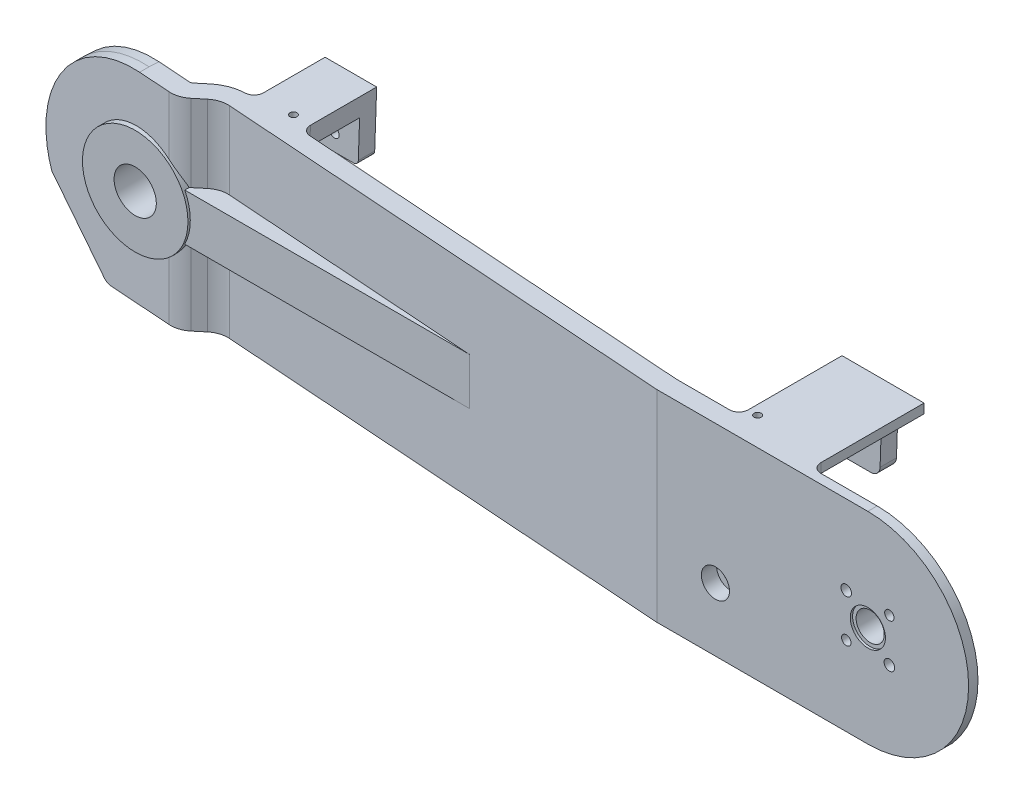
SolidWorks part; units mm, degrees
ref_plane "Plan de face" through (0, 0, 0) normal (0, 0, 1) x (1, 0, 0)
ref_plane "Plan de dessus" through (0, 0, 0) normal (0, 1, 0) x (1, 0, 0)
ref_plane "Plan de droite" through (0, 0, 0) normal (1, 0, 0) x (0, 0, -1)
ref_plane "Face-avt bras droit01_Rendre symétrique" through (0, 0, 112) normal (0, 0, -1) x (1, 0, 0)
ref_plane "Dessus-avt bras droit01_Rendre symétrique" through (0, 0, 112) normal (0, 1, 0) x (1, 0, 0)
ref_plane "Droite-avt bras droit01_Rendre symétrique" through (0, 0, 112) normal (1, 0, 0) x (0, 0, 1)
ref_plane "Plan1-avt bras droit01_Rendre symétrique" through (-65, 0, 112) normal (1, 0, 0) x (0, 0, 1)
ref_plane "Plan2-avt bras droit01_Rendre symétrique" through (0, 0, 107) normal (0, 0, -1) x (1, 0, 0)
mirrored part "avt bras droit01_Rendre symétrique"
other "<avt bras droit01>-<Enlèv. mat.-Extru.10>"
sketch "Esquisse1" plane through (-8.3003, 0, 118.6995) normal (0.0698, 0, -0.9976) x (-0.9976, 0, -0.0698)
  line L0 (374.2222, 0) -> (255.539, 0) construction
  line L1 (304.4642, -13.4937) -> (373.9552, -53.6144) construction
  line L2 (311.0924, 0) -> (380.1252, -39.8561) construction
  line L3 (345.6088, -19.9281) -> (348.779, -21.7584)
  line L4 (349.2614, -24.8331) -> (341.7072, -33.1734)
  line L5 (339.2249, -33.5628) -> (335.3077, -31.3012)
  line L6 (350.0723, -15) -> (325.9058, -41.6816) construction
  line L7 (335.3077, -31.3012) -> (345.6088, -19.9281)
  line L8 (322.9411, -38.9964) -> (346.5797, -12.8976) construction
  arc A0 (341.7072, -33.1734) -> (339.2249, -33.5628) centre (340.2249, -31.8308) cw
  arc A1 (349.2614, -24.8331) -> (348.779, -21.7584) centre (347.779, -23.4905) ccw
  point P16 (340.6233, -34.3702)
  point P19 (350.9244, -22.997)
  dimension "D4" = 2
  dimension "D1" = 30
  dimension "D2" = 15
  dimension "D3" = 10
extrude "Extrusion1" add sketch "Esquisse1" against normal blind 4
fillet "Congé1" radius 4 2 edges at (-342.9307, -31.3012, 97.3048) (-353.2067, -19.9281, 96.5862)
sketch "Esquisse3" plane through (0, 0, 108) normal (0, 0, -1) x (-1, 0, 0)
  line L0 (288.1927, 17) -> (248.346, 17) construction
  line L1 (283.5, 43) -> (261.5, 43)
  line L2 (285.9983, 43) -> (90, 43) construction
  line L3 (261.5, 43) -> (262.4079, 17)
  line L4 (262.4079, 17) -> (282.5921, 17)
  line L5 (261.5, -17.7423) -> (261.5, 76.5444) construction
  line L6 (283.5, -21.9852) -> (283.5, 85.973) construction
  line L7 (272.5, -68.5937) -> (272.5, 142.1371) construction
  line L8 (282.5921, 17) -> (283.5, 43)
  point P15 (282.5921, 17)
  dimension "D1" = 26
  dimension "D2" = 2
  dimension "D3" = 2
  dimension "D4" = 11
  dimension "D5" = 272.5
  dimension "D6" = 22
extrude "Extrusion2" add sketch "Esquisse3" along normal blind 52
sketch "Esquisse4" plane through (0, 43, 0) normal (0, 1, 0) x (-1, 0, 0)
  line L0 (261.5, 100.0076) -> (283.5, 98.4692)
  line L1 (283.5, 98.4692) -> (283.5, 108)
  line L2 (283.5, 108) -> (261.5, 108)
  line L3 (261.5, 108) -> (261.5, 100.0076)
extrude "Enlèv. mat.-Extru.1" cut sketch "Esquisse4" against normal blind 52
sketch "Esquisse5" plane through (0, 17, 0) normal (0, -1, 0) x (1, 0, 0)
  line L0 (-283.9673, 94.4267) -> (-258.9183, 96.1783)
  line L1 (-262.4079, 95.9343) -> (-282.5921, 94.5229) construction
  line L5 (-258.9183, 96.1783) -> (-258.9183, 63)
  line L8 (-258.9183, 63) -> (-285.7473, 63)
  line L10 (-285.7473, 63) -> (-283.9673, 94.4267)
  line L11 (-262.4079, 56) -> (-282.5921, 56) construction
  dimension "D1" = 7
extrude "Enlèv. mat.-Extru.2" cut sketch "Esquisse5" against normal blind 18
fillet "Congé2" radius 2 1 edges at (-262.4079, 17, 59.5)
fillet "Congé3" radius 2 1 edges at (-282.5921, 17, 59.5)
ref_plane "Plan1" through (0, 0, 116) normal (0, 0, -1) x (-1, 0, 0)
sketch "Esquisse6" plane through (0, 0, 56) normal (0, 0, -1) x (-1, 0, 0)
  line L0 (283.5, -43) -> (261.5, -43)
  line L1 (285.4403, -43) -> (87.4759, -43) construction
  line L2 (261.5, -43) -> (262.6548, -9.9302)
  line L3 (264.6536, -8) -> (280.3464, -8)
  line L4 (282.3452, -9.9302) -> (283.5, -43)
  line L5 (272.5, 3.5787) -> (272.5, -77.0567) construction
  line L6 (261.5, -43) -> (261.5, 11.6966) construction
  line L7 (283.5, -43) -> (283.5, 7.7341) construction
  arc A0 (262.6548, -9.9302) -> (264.6536, -8) centre (264.6536, -10) cw
  arc A1 (282.3452, -9.9302) -> (280.3464, -8) centre (280.3464, -10) ccw
  dimension "D3" = 2
  dimension "D1" = 2
  dimension "D2" = 2
  dimension "D4" = 272.5
  dimension "D5" = 35
  dimension "D6" = 11
  dimension "D7" = 11
extrude "Extrusion3" add sketch "Esquisse6" against normal up to body separate body
sketch "Esquisse7" plane through (0, -8, 0) normal (0, 1, 0) x (-1, 0, 0)
  line L0 (286.294, 94.264) -> (257.961, 96.2453)
  line L1 (280.3464, 94.6799) -> (264.6536, 95.7773) construction
  line L2 (257.961, 96.2453) -> (257.961, 63)
  line L3 (257.961, 63) -> (286.294, 63)
  line L4 (286.294, 63) -> (286.294, 94.264)
  line L5 (280.3464, 56) -> (264.6536, 56) construction
  dimension "D1" = 7
extrude "Enlèv. mat.-Extru.3" cut sketch "Esquisse7" against normal blind 28
fillet "Congé4" radius 4 8 edges at (-285.4403, -41, 90.3139) (-285.4403, 41, 90.3139) (-63, 41, 104) (-28, 41, 108) (-283.4302, 41, 90.4545) (-261.5698, 41, 91.9831) (-283.4302, -41, 90.4545) (-261.5698, -41, 91.9831)
sketch "Esquisse8" plane through (0, 0, 100) normal (0, 0, -1) x (-1, 0, 0)
  circle A0 centre (0, 0) radius 6
extrude "Enlèv. mat.-Extru.4" cut sketch "Esquisse8" against normal through all
sketch "Esquisse9" plane through (0, 0, 112) normal (0, 0, 1) x (1, 0, 0)
  circle A0 centre (0, 0) radius 7.5
extrude "Enlèv. mat.-Extru.5" cut sketch "Esquisse9" against normal blind 1
sketch "Esquisse12" plane through (0, 0, 112) normal (0, 0, 1) x (1, 0, 0)
  circle A0 centre (-317.5, 0) radius 12.5
  dimension "D1" = 317.5
extrude "Extrusion5" add sketch "Esquisse12" against normal blind 18
sketch "Esquisse13" plane through (0, -43, 0) normal (0, -1, 0) x (1, 0, 0)
  line L0 (-295, 107) -> (-340, 107) construction
  line L1 (-303.3102, 107) -> (-332.2221, 107)
  line L2 (-303.3102, 107) -> (-303.3102, 113.6532)
  line L3 (-303.3102, 113.6532) -> (-332.2221, 113.6532)
  line L4 (-332.2221, 107) -> (-332.2221, 113.6532)
extrude "Enlèv. mat.-Extru.7" cut sketch "Esquisse13" against normal blind 110
fillet "Congé5" radius 2 1 edges at (-305, 0, 101.962)
sketch "Esquisse14" plane through (0, 0, 94) normal (0, 0, -1) x (-1, 0, 0)
  circle A0 centre (317.5, 0) radius 9
extrude "Enlèv. mat.-Extru.8" cut sketch "Esquisse14" against normal through all
ref_plane "Plan2" through (0, 0, 106) normal (0, 0, 1) x (1, 0, 0)
sketch "Esquisse15" plane through (0, 0, 106) normal (0, 0, 1) x (1, 0, 0)
  line L0 (81.5471, 0) -> (-384.2722, 0) construction
  line L2 (-150, -10) -> (-300, -10)
  line L3 (-150, -10) -> (-150, 10)
  line L4 (-150, 10) -> (-300, 10)
  line L5 (-300, -10) -> (-300, 10)
  dimension "D1" = 150
  dimension "D2" = 300
  dimension "D3" = 20
  dimension "D4" = 10
extrude "Extrusion6" add sketch "Esquisse15" against normal up to body separate body
sketch "Esquisse16" plane through (0, 0, 56) normal (0, 0, -1) x (-1, 0, 0)
  line L1 (302.2711, 118.4303) -> (-40.8115, 118.4303)
  line L2 (302.2711, 118.4303) -> (302.2711, -160.7774)
  line L3 (302.2711, -160.7774) -> (-40.8115, -160.7774)
  line L4 (-40.8115, 118.4303) -> (-40.8115, -160.7774)
extrude "Enlèv. mat.-Extru.9" cut sketch "Esquisse16" against normal blind 4
ref_plane "Plan3" through (-282.6595, 18.9302, 63) normal (0.0349, -0.9994, 0) x (0.9994, 0.0349, 0)
sketch "Esquisse18" plane through (0, 0, 63) normal (0, 0, 1) x (1, 0, 0)
  line L0 (-261.7794, 35) -> (-262.3405, 18.9302) construction
  line L1 (-264.3393, 17) -> (-280.6607, 17) construction
  line L2 (-282.6595, 18.9302) -> (-283.2206, 35) construction
  line L3 (-283.2206, 35) -> (-261.7794, 35) construction
  line L4 (-261.7794, 35) -> (-262.3405, 18.9302)
  line L5 (-264.3393, 17) -> (-280.6607, 17)
  line L6 (-282.6595, 18.9302) -> (-283.2206, 35)
  line L7 (-283.2206, 35) -> (-261.7794, 35)
  arc A0 (-264.3393, 17) -> (-262.3405, 18.9302) centre (-264.3393, 19) ccw construction
  arc A1 (-282.6595, 18.9302) -> (-280.6607, 17) centre (-280.6607, 19) ccw construction
  arc A2 (-264.3393, 17) -> (-262.3405, 18.9302) centre (-264.3393, 19) ccw
  arc A3 (-282.6595, 18.9302) -> (-280.6607, 17) centre (-280.6607, 19) ccw
extrude "Extrusion7" add sketch "Esquisse18" along normal blind 4
sketch "Esquisse19" plane through (0, 0, 63) normal (0, 0, 1) x (1, 0, 0)
  line L0 (-261.7444, -36) -> (-262.6548, -9.9302) construction
  line L1 (-261.7444, -36) -> (-283.2556, -36) construction
  line L2 (-282.3452, -9.9302) -> (-283.2556, -36) construction
  line L3 (-264.6536, -8) -> (-280.3464, -8) construction
  line L4 (-261.7444, -36) -> (-262.6548, -9.9302)
  line L5 (-261.7444, -36) -> (-283.2556, -36)
  line L6 (-282.3452, -9.9302) -> (-283.2556, -36)
  line L7 (-264.6536, -8) -> (-280.3464, -8)
  arc A0 (-262.6548, -9.9302) -> (-264.6536, -8) centre (-264.6536, -10) ccw construction
  arc A1 (-280.3464, -8) -> (-282.3452, -9.9302) centre (-280.3464, -10) ccw construction
  arc A2 (-262.6548, -9.9302) -> (-264.6536, -8) centre (-264.6536, -10) ccw
  arc A3 (-280.3464, -8) -> (-282.3452, -9.9302) centre (-280.3464, -10) ccw
extrude "Extrusion8" add sketch "Esquisse19" along normal blind 4
sketch "Esquisse20" plane through (0, 0, 63) normal (0, 0, 1) x (1, 0, 0)
  line L0 (-58.2269, 16.8604) -> (-58.7929, 33.0686) construction
  line L1 (-43.7707, 13) -> (-54.2293, 13) construction
  line L2 (-39.231, 32.3855) -> (-39.7731, 16.8604) construction
  line L3 (-58.7929, 33.0686) -> (-39.231, 32.3855) construction
  line L4 (-58.2269, 16.8604) -> (-58.7929, 33.0686)
  line L5 (-43.7707, 13) -> (-54.2293, 13)
  line L6 (-39.231, 32.3855) -> (-39.7731, 16.8604)
  line L7 (-58.7929, 33.0686) -> (-39.231, 32.3855)
  arc A0 (-58.2269, 16.8604) -> (-54.2293, 13) centre (-54.2293, 17) ccw construction
  arc A1 (-43.7707, 13) -> (-39.7731, 16.8604) centre (-43.7707, 17) ccw construction
  arc A2 (-58.2269, 16.8604) -> (-54.2293, 13) centre (-54.2293, 17) ccw
  arc A3 (-43.7707, 13) -> (-39.7731, 16.8604) centre (-43.7707, 17) ccw
extrude "Extrusion9" add sketch "Esquisse20" along normal blind 4
sketch "Esquisse21" plane through (0, 0, 60) normal (0, 0, -1) x (-1, 0, 0)
  circle A0 centre (65, -16) radius 3.25
  point P0 (65, -16)
  dimension "D1" = 6.5
extrude "Enlèv. mat.-Extru.10" cut sketch "Esquisse21" against normal blind 60
sketch "Esquisse22" plane through (0, 0, 60) normal (0, 0, -1) x (-1, 0, 0)
  circle A0 centre (65, -16) radius 4
  point P0 (65, -16)
  dimension "D1" = 8
extrude "Enlèv. mat.-Extru.11" cut sketch "Esquisse22" against normal blind 5.2
sketch "Esquisse23" plane through (0, 0, 112) normal (0, 0, 1) x (1, 0, 0)
  circle A0 centre (-65, -16) radius 6
  point P0 (-65, -16)
  dimension "D1" = 12
extrude "Enlèv. mat.-Extru.12" cut sketch "Esquisse23" against normal blind 6.5
sketch "Esquisse24" plane through (0, 0, 60) normal (0, 0, -1) x (-1, 0, 0)
  line L0 (377.0708, -15) -> (-51.0268, -15) construction
  line L2 (0, -101.4035) -> (0, 96.4568) construction
  line L3 (272.5, -101.4035) -> (272.5, 96.4568) construction
  line L4 (-51.0268, 0) -> (377.0708, 0) construction
  line L5 (280.3464, -8) -> (264.6536, -8) construction
  line L6 (377.0708, 24) -> (-51.0268, 24) construction
  line L7 (280.6607, 17) -> (264.3393, 17) construction
  line L8 (377.0708, 31) -> (-51.0268, 31) construction
  line L9 (50, 96.4568) -> (50, -101.4035) construction
  dimension "D1" = 272.5
  dimension "D2" = 7
  dimension "D3" = 7
  dimension "D4" = 7
  dimension "D5" = 50
sketch "Esquisse25" plane through (0, 0, 60) normal (0, 0, -1) x (-1, 0, 0)
  line L1 (272.5, -101.4035) -> (272.5, 96.4568) construction
  line L2 (377.0708, 31) -> (-51.0268, 31) construction
  circle A0 centre (272.5, 31) radius 2
extrude "Enlèv. mat.-Extru.13" cut sketch "Esquisse25" against normal blind 10
hole_wizard "Trou taraudé M41" positions "Esquisse3D1" profile "Esquisse26" tap size "M4" standard "ISO"
sketch3d "Esquisse3D1"
  line L0 (-377.0708, -15, 60) -> (51.0268, -15, 60) construction
  line L1 (-272.5, -101.4035, 60) -> (-272.5, 96.4568, 60) construction
  point P0 (-272.5, -15, 60)
  point P6 (-272.5, 24.1397, 60)
sketch "Esquisse26" plane through (-272.5, -15, 60) normal (1, 0, 0) x (0, 1, 0)
  line L0 (0, 0) -> (0, 11.0914)
  line L1 (0, 11.0914) -> (1.65, 10.1)
  line L2 (1.65, 10.1) -> (1.65, 8)
  line L3 (1.65, 8) -> (2, 8)
  line L4 (2, 8) -> (2, 0)
  line L5 (2, 0) -> (0, 0)
  line L10 (0, 11.0914) -> (-1.65, 10.1) construction
  line L11 (0, -6.35) -> (0, 107.95) construction
  dimension "Diamètre du trou pour taraudage" = 3.3
  dimension "Profondeur du trou pour taraudage" = 10.1
  dimension "Diamètre principal du filetage" = 4
  dimension "Profondeur du filetage" = 8
  dimension "Angle de pointe" = 118
hole_wizard "Trou taraudé M4x0.71" positions "Esquisse3D3" profile "Esquisse29" tap size "M4x0.7" standard "Ansi Métrique"
sketch3d "Esquisse3D3"
  line L0 (-28, 43, 60) -> (-63, 43, 60) construction
  line L1 (-50, 98.1053, 0) -> (-50, -132.7169, 0) construction
  point P0 (-49.3005, 27, 60)
  dimension "D1" = 16
  dimension "D2" = 50
sketch "Esquisse29" plane through (-49.3005, 27, 60) normal (1, 0, 0) x (0, 1, 0)
  line L0 (0, 0) -> (0, 11.0914)
  line L1 (0, 11.0914) -> (1.65, 10.1)
  line L2 (1.65, 10.1) -> (1.65, 8)
  line L3 (1.65, 8) -> (2, 8)
  line L4 (2, 8) -> (2, 0)
  line L5 (2, 0) -> (0, 0)
  line L10 (0, 11.0914) -> (-1.65, 10.1) construction
  line L11 (0, -6.35) -> (0, 107.95) construction
  dimension "Diamètre du trou pour taraudage" = 3.3
  dimension "Profondeur du trou pour taraudage" = 10.1
  dimension "Diamètre principal du filetage" = 4
  dimension "Profondeur du filetage" = 8
  dimension "Angle de pointe" = 118
sketch "Esquisse30" plane through (0, 0, 100) normal (0, 0, -1) x (-1, 0, 0)
  line L0 (32.1871, 0) -> (-32.4168, 0) construction
  line L1 (0, 0) -> (-19.7458, -19.7458) construction
  line L2 (-19.7458, -19.7458) -> (22.2267, 22.2267) construction
  line L3 (0, 0) -> (18.9581, -18.9581) construction
  line L4 (18.9581, -18.9581) -> (-21.8334, 21.8334) construction
  circle A0 centre (9.1924, -9.1924) radius 2
  circle A1 centre (-9.1924, 9.1924) radius 2
  circle A2 centre (9.1924, 9.1924) radius 2.25
  circle A3 centre (-9.1924, -9.1924) radius 2.25
  dimension "D3" = 13
  dimension "D1" = 45
  dimension "D2" = 45
  dimension "D4" = 13
  dimension "D5" = 13
  dimension "D6" = 13
extrude "Enlèv. mat.-Extru.14" cut sketch "Esquisse30" against normal through all
sketch "Esquisse31" plane through (0, 43, 0) normal (0, 1, 0) x (-1, 0, 0)
  line L0 (63, 60) -> (63, 100) construction
  line L1 (261.5, 60) -> (283.5, 60) construction
  line L2 (28, 60) -> (63, 60) construction
  circle A0 centre (59, 100) radius 1.5
  circle A1 centre (269, 88) radius 1.5
  point P6 (272.5, 60)
  dimension "D1" = 4
  dimension "D2" = 210
  dimension "D3" = 28
  dimension "D4" = 40
extrude "Enlèv. mat.-Extru.15" cut sketch "Esquisse31" against normal blind 8
